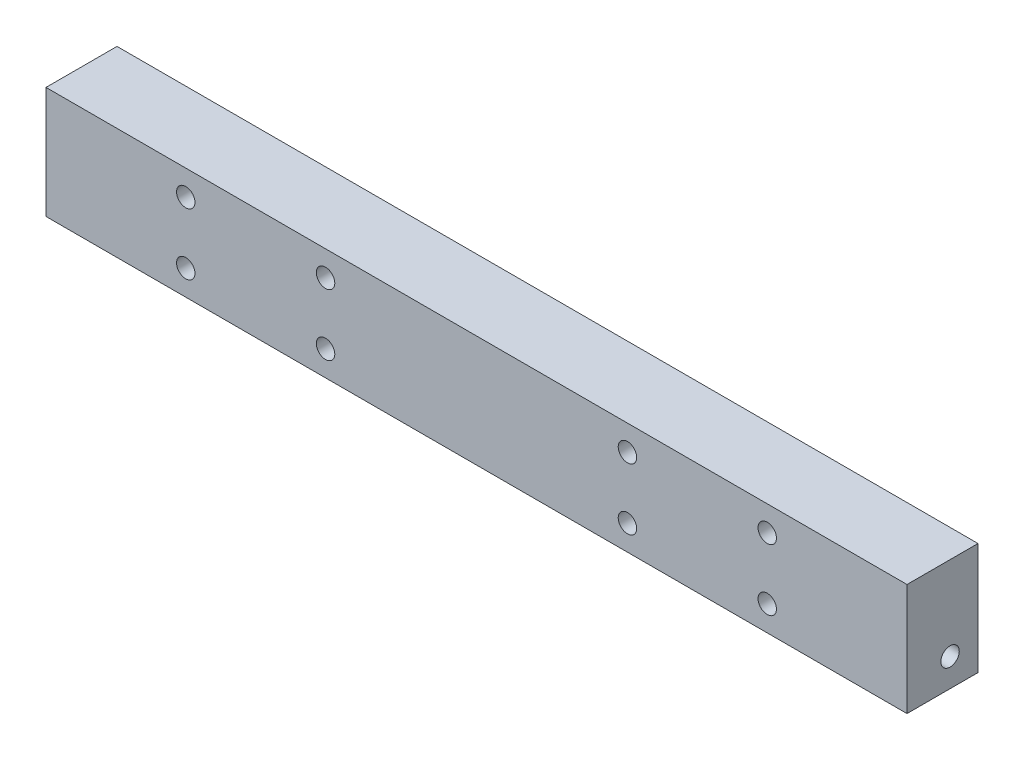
SolidWorks part; units mm, degrees
ref_plane "Front Plane" through (0, 0, 0) normal (0, 0, 1) x (1, 0, 0)
ref_plane "Top Plane" through (0, 0, 0) normal (0, 1, 0) x (1, 0, 0)
ref_plane "Right Plane" through (0, 0, 0) normal (1, 0, 0) x (0, 0, -1)
sketch "Sketch1" plane through (0, 0, 0) normal (0, 0, 1) x (1, 0, 0)
  line L1 (-77, 10) -> (77, 10)
  line L2 (-77, 10) -> (-77, -10)
  line L3 (-77, -10) -> (77, -10)
  line L4 (77, 10) -> (77, -10)
  line L5 (-77, 10) -> (77, -10) construction
  line L6 (-77, -10) -> (77, 10) construction
  point P0 (0, 0)
  dimension "D1" = 20
  dimension "D2" = 154
extrude "Boss-Extrude1" add sketch "Sketch1" along normal blind 12.7
sketch "Sketch2" plane through (77, 0, 0) normal (1, 0, 0) x (0, 0, -1)
  line L2 (-12.7, -10) -> (0, -10) construction
  line L4 (0, -10) -> (0, 10) construction
  circle A1 centre (-5, -5) radius 1.65
  dimension "D1" = 3.3
  dimension "D2" = 5
  dimension "D4" = 5
extrude "Cut-Extrude1" cut sketch "Sketch2" against normal blind 22
sketch "Sketch3" plane through (0, 0, 12.7) normal (0, 0, 1) x (1, 0, 0)
  line L0 (0, 0) -> (2.3295, 0) construction
  line L1 (77, -10) -> (77, 10) construction
  circle A0 centre (52, 5.5) radius 1.65
  circle A1 centre (52, -5.5) radius 1.65
  circle A2 centre (27, 5.5) radius 1.65
  circle A3 centre (27, -5.5) radius 1.65
  point P7 (0, 0)
  point P8 (0, 0)
  point P15 (0, 0)
  point P16 (0, 0)
  point P17 (0, 0)
  dimension "D1" = 11
  dimension "D2" = 3.3
  dimension "D3" = 25
  dimension "D4" = 11
  dimension "D5" = 25
extrude "Cut-Extrude2" cut sketch "Sketch3" against normal through all
mirror "Mirror1" about plane through (0, 0, 0) normal (1, 0, 0) of "Cut-Extrude2", "Cut-Extrude1"
